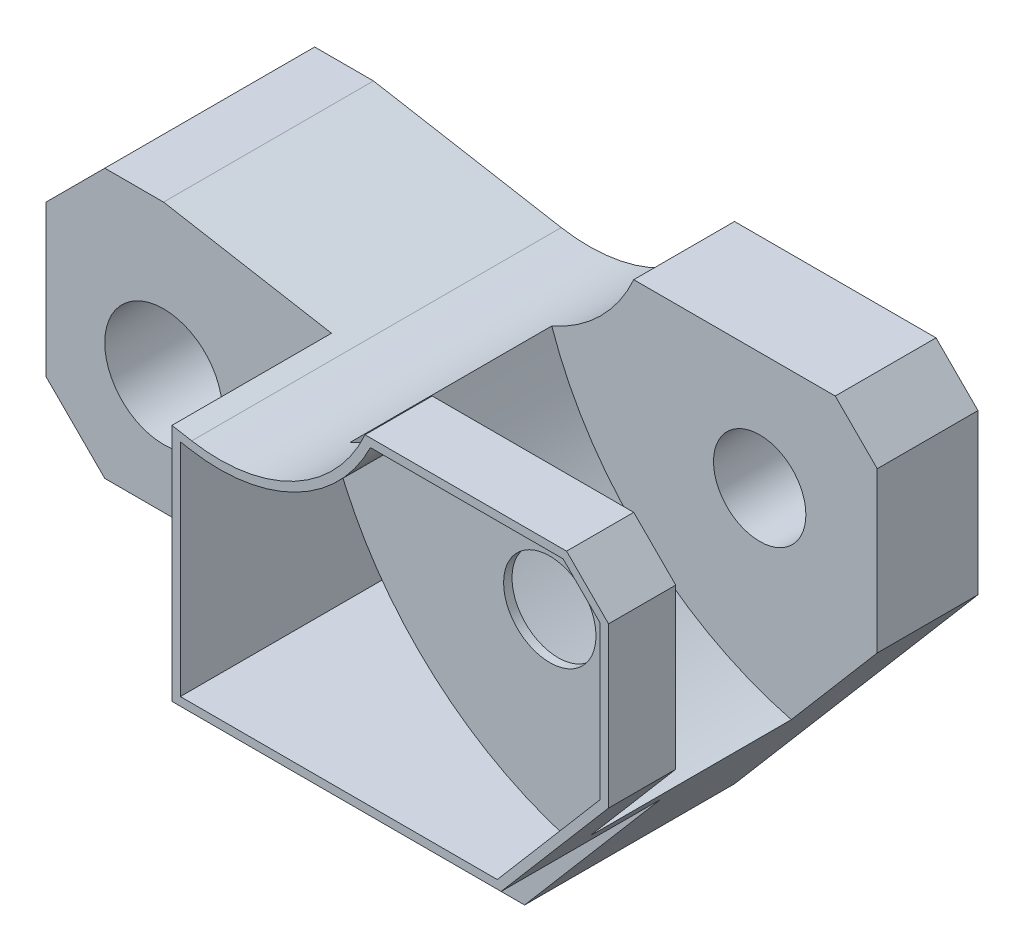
SolidWorks part; units mm, degrees
ref_plane "Front" through (0, 0, 0) normal (0, 0, 1) x (1, 0, 0)
ref_plane "Top" through (0, 0, 0) normal (0, 1, 0) x (1, 0, 0)
ref_plane "Right" through (0, 0, 0) normal (1, 0, 0) x (0, 0, -1)
sketch "Sketch1" plane through (0, 0, 0) normal (0, 0, 1) x (1, 0, 0)
  line L0 (0, 0) -> (0, 32)
  line L1 (0, 32) -> (14, 32)
  line L2 (14, 32) -> (36.3614, 28.0571)
  line L3 (57, 39) -> (86, 39)
  line L4 (86, 39) -> (86, 15)
  line L5 (86, 15) -> (57, -19)
  line L6 (57, -19) -> (51.297, -19)
  line L7 (0, 0) -> (39.5755, 0)
  arc A0 (36.3614, 28.0571) -> (57, 39) centre (39.6607, 46.7684) ccw
  arc A1 (39.5755, 0) -> (44.5212, -4.2647) centre (39.5755, -5) cw
  arc A2 (44.5212, -4.2647) -> (51.297, -19) centre (73.2059, 0) ccw
extrude "Boss-Extrude1" add sketch "Sketch1" along normal mid plane 44
chamfer "Chamfer1" distance 7 angle 45 2 edges at (0, 0, 0) (0, 32, 0)
chamfer "Chamfer2" distance 5 angle 45 1 edges at (86, 39, 0)
sketch "Sketch2" plane through (0, 0, 22) normal (0, 0, 1) x (1, 0, 0)
  line L0 (7, 0) -> (39.5755, 0) construction
  line L1 (0, 25) -> (0, 7) construction
  circle A0 centre (14, 14) radius 7
  dimension "D3" = 14
  dimension "D1" = 14
  dimension "D2" = 14
extrude "Cut-Extrude1" cut sketch "Sketch2" against normal through all
sketch "Sketch3" plane through (0, 39, 0) normal (0, 1, 0) x (1, 0, 0)
  line L0 (0, -22) -> (0, 22) construction
  line L1 (0, -3) -> (34, -3)
  line L2 (0, -3) -> (0, -22)
  line L3 (0, -22) -> (34, -22)
  line L4 (34, -3) -> (34, -22)
  line L5 (36.3614, -22) -> (14, -22) construction
  line L6 (86, 22) -> (86, -22) construction
  dimension "D1" = 19
  dimension "D2" = 52
extrude "Cut-Extrude2" cut sketch "Sketch3" against normal through all
sketch "Sketch4" plane through (0, 0, 22) normal (0, 0, 1) x (1, 0, 0)
  line L0 (39.5755, 0) -> (73.2059, 0)
  line L1 (57, -19) -> (86, 15) construction
  line L2 (51.297, -19) -> (57, -19) construction
  line L3 (51.297, -19) -> (57, -19)
  line L4 (57, -19) -> (73.2059, 0)
  arc A0 (44.5212, -4.2647) -> (39.5755, 0) centre (39.5755, -5) ccw construction
  arc A1 (44.5212, -4.2647) -> (51.297, -19) centre (73.2059, 0) ccw construction
  arc A2 (44.5212, -4.2647) -> (39.5755, 0) centre (39.5755, -5) ccw
  arc A3 (44.5212, -4.2647) -> (51.297, -19) centre (73.2059, 0) ccw
extrude "Cut-Extrude3" cut sketch "Sketch4" against normal blind 19
ref_plane "Plane1" through (0, 0, -10) normal (0, 0, -1) x (-1, 0, 0)
sketch "Sketch5" plane through (0, 0, -10) normal (0, 0, -1) x (-1, 0, 0)
  line L0 (-57, -19) -> (-86, 15) construction
  line L1 (-81, 39) -> (-57, 39) construction
  line L2 (-86, 15) -> (-86, 34) construction
  line L3 (-81, 39) -> (-86, 34) construction
  line L4 (-75.7647, 3) -> (-86, 15)
  line L5 (-86, 15) -> (-86, 34)
  line L6 (-81, 39) -> (-86, 34)
  line L7 (-81, 39) -> (-57, 39)
  arc A0 (-75.7647, 3) -> (-47.2369, 29.3443) centre (-86, 42.7019) ccw
  arc A1 (-57, 39) -> (-36.3614, 28.0571) centre (-39.6607, 46.7684) ccw construction
  arc A2 (-57, 39) -> (-47.2369, 29.3443) centre (-39.6607, 46.7684) ccw
  dimension "D2" = 41
  dimension "D1" = 36
extrude "Cut-Extrude4" cut sketch "Sketch5" against normal blind 24
shell "Shell1" thickness 1
sketch "Sketch6" plane through (0, 0, 22) normal (0, 0, 1) x (1, 0, 0)
  line L0 (81, 39) -> (57, 39) construction
  line L1 (86, 15) -> (86, 34) construction
  circle A0 centre (72, 25) radius 5.5
  dimension "D1" = 11
  dimension "D2" = 14
  dimension "D3" = 14
extrude "Cut-Extrude5" cut sketch "Sketch6" against normal through all
equation "\"A\"= 86"
equation "\"B\"= 58"
equation "\"C\"= 44"
equation "\"D3@Sketch1\"=\"A\""
equation "\"D8@Sketch1\"=\"B\""
equation "\"D1@Boss-Extrude1\"=\"C\""
